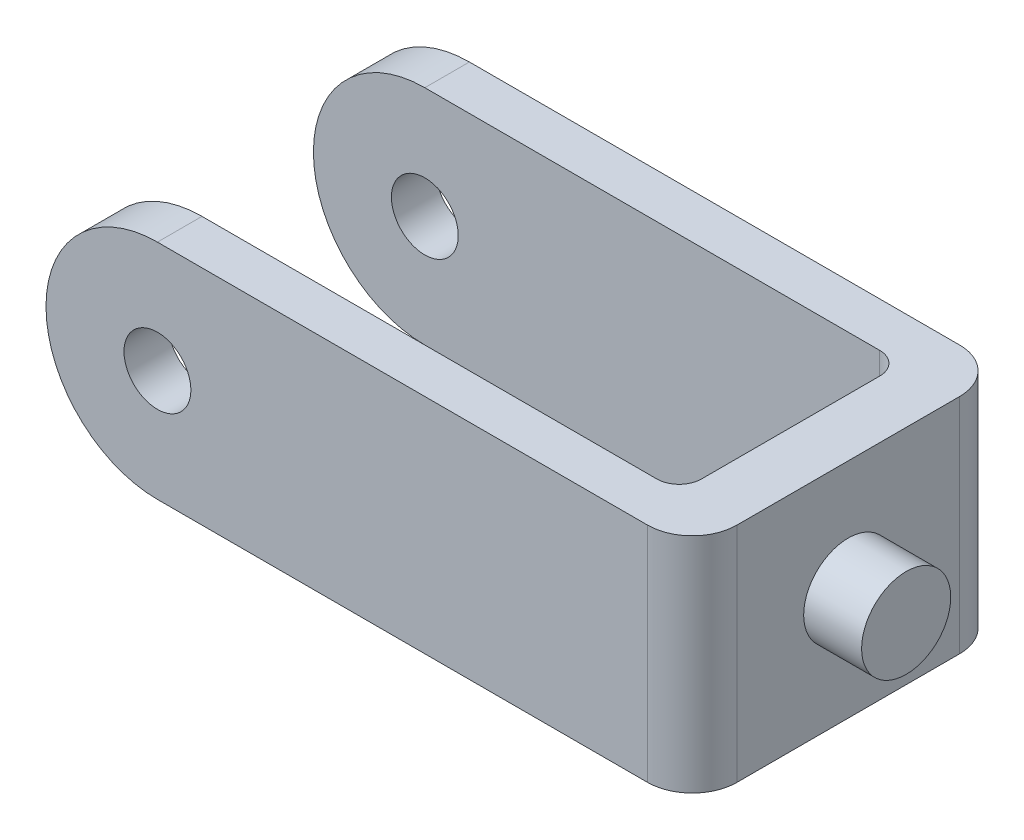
SolidWorks part; units mm, degrees
ref_plane "Alzado" through (0, 0, 0) normal (0, 0, 1) x (1, 0, 0)
ref_plane "Planta" through (0, 0, 0) normal (0, 1, 0) x (1, 0, 0)
ref_plane "Vista lateral" through (0, 0, 0) normal (1, 0, 0) x (0, 0, -1)
sketch "Croquis1" plane through (0, 0, 0) normal (0, 1, 0) x (1, 0, 0)
  line L1 (-45.1423, 40) -> (74.8577, 40)
  line L2 (-45.1423, 40) -> (-45.1423, 30)
  line L3 (-45.1423, -30) -> (74.8577, -30)
  line L4 (74.8577, 40) -> (74.8577, -30)
  line L5 (-45.1423, -20) -> (-45.1423, -30)
  line L6 (61.9248, 30) -> (-45.1423, 30)
  line L7 (61.9248, 30) -> (61.9248, -20)
  line L8 (61.9248, -20) -> (-45.1423, -20)
  dimension "D1" = 70
  dimension "D2" = 10
  dimension "D3" = 10
  dimension "D4" = 120
extrude "Saliente-Extruir1" add sketch "Croquis1" along normal blind 50
fillet "Redondeo1" radius 10 2 edges at (74.8577, 25, 30) (74.8577, 25, -40)
sketch "Croquis2" plane through (0, 0, -40) normal (0, 0, -1) x (-1, 0, 0)
  line L0 (45.1423, 50) -> (45.1423, 0) construction
  circle A0 centre (45.1423, 25) radius 25
extrude "Saliente-Extruir2" add sketch "Croquis2" against normal up to vertex (10 mm away)
sketch "Croquis3" plane through (0, 0, 20) normal (0, 0, -1) x (-1, 0, 0)
  line L0 (45.1423, 50) -> (45.1423, 0) construction
  circle A0 centre (45.1423, 25) radius 25
extrude "Saliente-Extruir3" add sketch "Croquis3" against normal up to vertex (10 mm away)
sketch "Croquis4" plane through (0, 0, -40) normal (0, 0, -1) x (-1, 0, 0)
  circle A0 centre (45.1423, 25) radius 7.5
  dimension "D1" = 15
extrude "Cortar-Extruir1" cut sketch "Croquis4" against normal through all
sketch "Croquis5" plane through (74.8577, 0, 0) normal (1, 0, 0) x (0, 0, -1)
  line L0 (-20, 50) -> (30, 0) construction
  circle A0 centre (5, 25) radius 10
  dimension "D1" = 20
extrude "Saliente-Extruir4" add sketch "Croquis5" along normal blind 13
fillet "Redondeo2" radius 5 2 edges at (61.9248, 25, -30) (61.9248, 25, 20)
